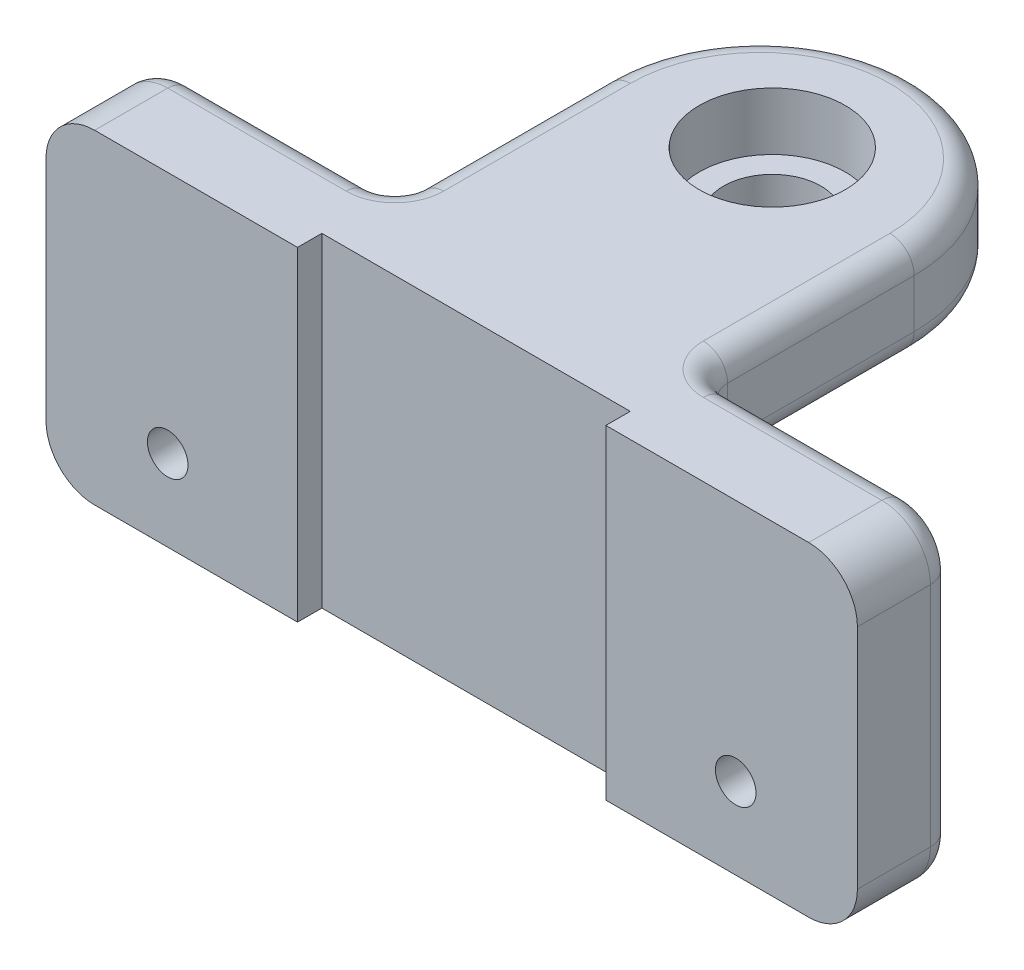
SolidWorks part; units mm, degrees
ref_plane "Alzado" through (0, 0, 0) normal (0, 0, 1) x (1, 0, 0)
ref_plane "Planta" through (0, 0, 0) normal (0, 1, 0) x (1, 0, 0)
ref_plane "Vista lateral" through (0, 0, 0) normal (1, 0, 0) x (0, 0, -1)
sketch "Sketch1" plane through (0, 0, 0) normal (0, 0, 1) x (1, 0, 0)
  line L1 (0, 40) -> (100, 40)
  line L2 (0, 40) -> (0, 0)
  line L3 (0, 0) -> (100, 0)
  line L4 (100, 40) -> (100, 0)
  dimension "D1" = 100
  dimension "D2" = 40
extrude "Boss-Extrude1" add sketch "Sketch1" along normal blind 12
sketch "Sketch2" plane through (0, 40, 0) normal (0, 1, 0) x (1, 0, 0)
  line L0 (31, 0) -> (31, 26)
  line L1 (100, 0) -> (0, 0) construction
  line L2 (69, 26) -> (69, 0)
  line L3 (69, 0) -> (31, 0)
  line L4 (100, -12) -> (0, -12) construction
  arc A0 (31, 26) -> (69, 26) centre (50, 26) cw
  point P9 (50, -12)
  dimension "D2" = 19
  dimension "D1" = 38
  dimension "D3" = 50
extrude "Boss-Extrude2" add sketch "Sketch2" against normal blind 12
sketch "Sketch3" plane through (0, 40, 0) normal (0, 1, 0) x (1, 0, 0)
  line L0 (100, -12) -> (0, -12) construction
  line L1 (31, -9) -> (69, -9)
  line L2 (31, -9) -> (31, -12)
  line L3 (31, -12) -> (69, -12)
  line L4 (69, -9) -> (69, -12)
  point P6 (50, -12)
  dimension "D1" = 38
  dimension "D2" = 3
  dimension "D3" = 50
extrude "Cut-Extrude1" cut sketch "Sketch3" against normal blind 40 from offset 0 contours L2 L1 L4 L3
hole_wizard "CBORE for M10 Hex Socket Head Cap Screw2" positions "Sketch9" profile "Sketch8" counterbore size "M10" standard "DIN"
sketch "Sketch9" plane through (0, 40, 0) normal (0, 1, 0) x (1, 0, 0)
  point P0 (49.5993, 27.9058)
sketch "Sketch8" plane through (49.5993, 40, -27.9058) normal (1, 0, 0) x (0, 0, 1)
  line L0 (0, 0) -> (0, 40)
  line L1 (0, 40) -> (6, 40)
  line L3 (6, 40) -> (6, 7.1)
  line L4 (6, 7.1) -> (9, 7.1)
  line L5 (9, 7.1) -> (9, 0)
  line L7 (9, 0) -> (0, 0)
  line L11 (0, -6.35) -> (0, 107.95) construction
  dimension "Thru Hole Dia." = 12
  dimension "Thru Hole Depth" = 40
  dimension "C'Bore Dia." = 18
  dimension "C'Bore Depth" = 7.1
fillet "Fillet10" radius 6 1 edges at (100, 0, 6)
fillet "Fillet11" radius 6 1 edges at (100, 40, 6)
fillet "Fillet12" radius 6 1 edges at (0, 40, 6)
fillet "Fillet13" radius 6 1 edges at (0, 0, 6)
fillet "Fillet14" radius 3 18 edges at (31, 34, 0) (69, 34, 0) (31, 40, -13) (31, 28, -13) (50, 40, -45) (50, 28, -45) (69, 40, -13) (69, 28, -13) (50, 28, 0) (1.7574, 38.2426, 0) (18.5, 40, 0) (81.5, 40, 0) (98.2426, 38.2426, 0) (100, 20, 0) (98.2426, 1.7574, 0) (1.7574, 1.7574, 0) (0, 20, 0) (50, 0, 0)
sketch "Sketch11" plane through (0, 0, 0) normal (0, 0, -1) x (-1, 0, 0)
  line L0 (0, 34) -> (0, 6) construction
  line L1 (-31, 40) -> (-6, 40) construction
  line L2 (-100, 6) -> (-100, 34) construction
  circle A0 centre (-85, 10) radius 2.5
  circle A1 centre (-15, 10) radius 2.5
  dimension "D1" = 5
  dimension "D4" = 15
  dimension "D2" = 15
  dimension "D3" = 30
extrude "Cut-Extrude3" cut sketch "Sketch11" against normal through all contours A1 | A0
